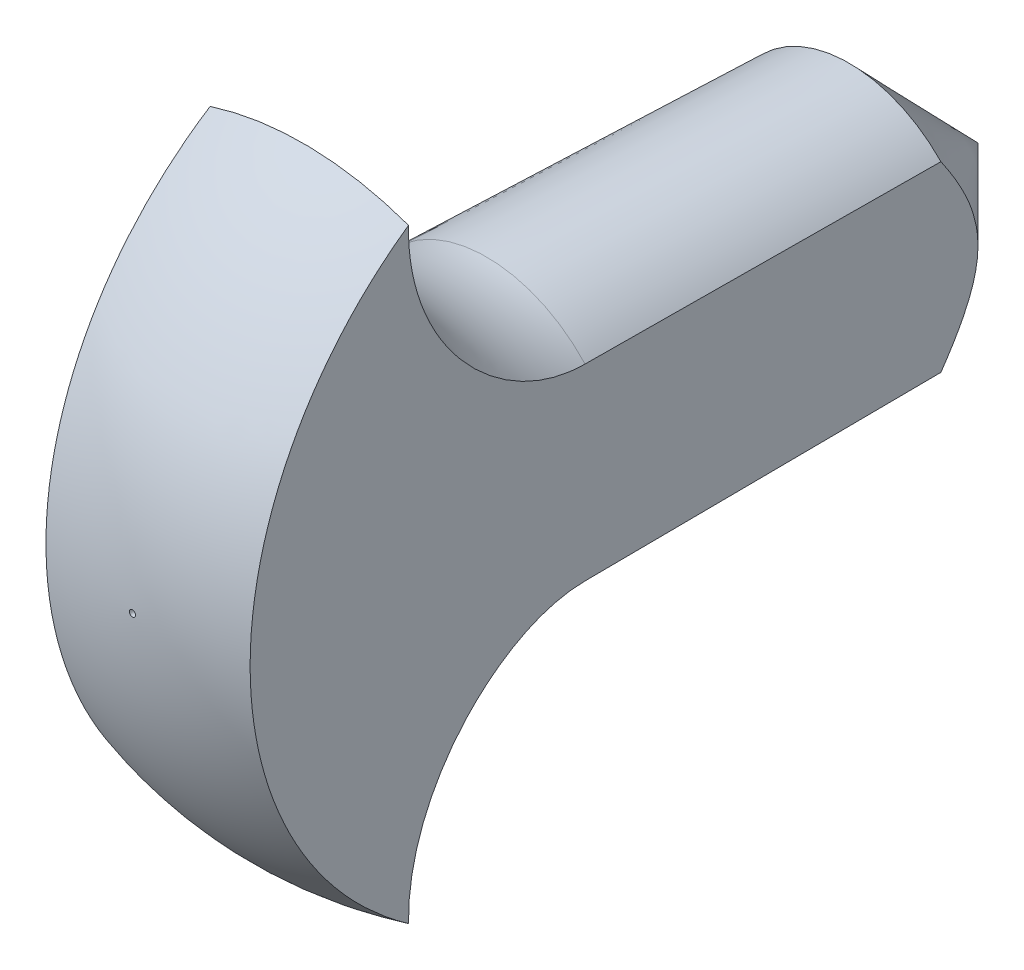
SolidWorks part; units mm, degrees
ref_plane "前视基准面" through (0, 0, 0) normal (0, 0, 1) x (1, 0, 0)
ref_plane "上视基准面" through (0, 0, 0) normal (0, 1, 0) x (1, 0, 0)
ref_plane "右视基准面" through (0, 0, 0) normal (1, 0, 0) x (0, 0, -1)
other "Configuration Table"
sketch "草图6" plane through (0, 0, 0) normal (0, 1, 0) x (1, 0, 0)
  line L1 (17.9611, -5.0641) -> (17.9611, 40.9237)
  line L2 (17.9611, 40.9237) -> (1.5896, 57.2952)
  line L3 (1.5896, 57.2952) -> (0, -28.3138)
  line L4 (0, -28.3138) -> (0, -50)
  arc A0 (0, -50) -> (41.2108, -28.3138) centre (0, 0) ccw
  arc A1 (41.2108, -28.3138) -> (17.9611, -5.0641) centre (41.2108, -5.0641) cw
revolve "旋转2" add sketch "草图6" angle 360 about L3
sketch "草图7" plane through (0, 0, 0) normal (0, 1, 0) x (1, 0, 0)
  line L0 (13.0772, 45.8076) -> (13.0772, -48.2596)
  line L1 (17.9611, 40.9237) -> (1.5896, 57.2952) construction
  line L2 (13.0772, 45.8076) -> (17.9611, 40.9237)
  line L3 (17.9611, 40.9237) -> (17.9611, -5.0641)
  line L4 (1.5896, 57.2952) -> (0.4378, -4.7388) construction
  line L8 (-17.0856, -4.4134) -> (17.9611, -5.0641) construction
  line L9 (0.4378, -4.7388) -> (-0.8051, -49.9851) construction
  line L10 (-10.3164, 46.242) -> (-15.3783, 41.5428)
  line L11 (-15.3783, 41.5428) -> (-17.0856, -4.4134)
  line L12 (-10.3164, 46.242) -> (-13.8086, -47.7603)
  arc A0 (0, -50) -> (41.2108, -28.3138) centre (0, 0) ccw construction
  arc A1 (17.9611, -5.0641) -> (41.2108, -28.3138) centre (41.2108, -5.0641) ccw
  arc A2 (41.2108, -28.3138) -> (13.0772, -48.2596) centre (0, 0) cw
  arc A3 (-41.1824, -26.7839) -> (-13.8086, -47.7603) centre (1.0511, -0.0195) ccw
  arc A4 (-17.0856, -4.4134) -> (-41.1824, -26.7839) centre (-40.3192, -3.5502) cw
extrude "切除-拉伸7" cut sketch "草图7" against normal through all and the other way through all
